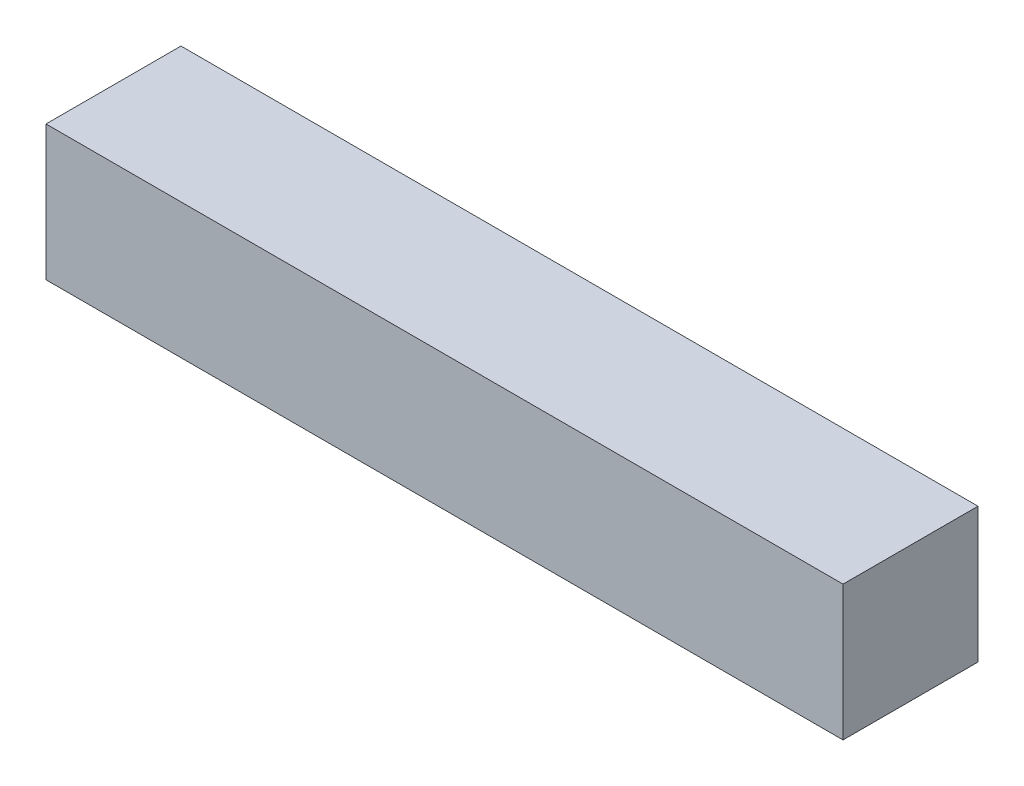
SolidWorks part; units mm, degrees
ref_plane "Front Plane" through (0, 0, 0) normal (1, 0, 0) x (0, 1, 0)
ref_plane "Top Plane" through (0, 0, 0) normal (0, 0, 1) x (0, 1, 0)
ref_plane "Right Plane" through (0, 0, 0) normal (0, 1, 0) x (-1, 0, 0)
sketch "Sketch1" plane through (0, 0, 0) normal (1, 0, 0) x (0, 1, 0)
  line L0 (-6.35, -12.7) -> (6.35, -12.7)
  line L1 (6.35, -12.7) -> (6.35, 0)
  line L2 (6.35, 0) -> (-6.35, 0)
  line L3 (-6.35, 0) -> (-6.35, -12.7)
extrude "Panel_or_block" add sketch "Sketch1" along normal blind 75
